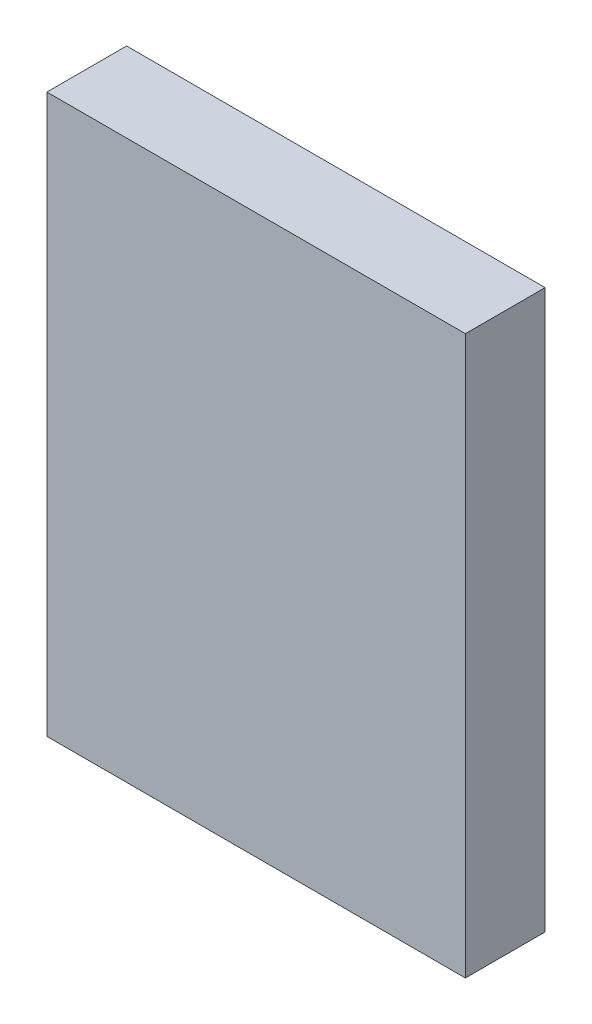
SolidWorks part; units mm, degrees
ref_plane "Plan de face" through (0, 0, 0) normal (0, 0, 1) x (1, 0, 0)
ref_plane "Plan de dessus" through (0, 0, 0) normal (0, 1, 0) x (1, 0, 0)
ref_plane "Plan de droite" through (0, 0, 0) normal (1, 0, 0) x (0, 0, -1)
sketch "Esquisse1" plane through (0, 0, 0) normal (0, 0, 1) x (1, 0, 0)
  line L1 (0, 0) -> (210, 0)
  line L2 (0, 0) -> (0, 280)
  line L3 (0, 280) -> (210, 280)
  line L4 (210, 0) -> (210, 280)
  dimension "D1" = 280
  dimension "D2" = 210
extrude "Boss.-Extru.1" add sketch "Esquisse1" along normal blind 40
